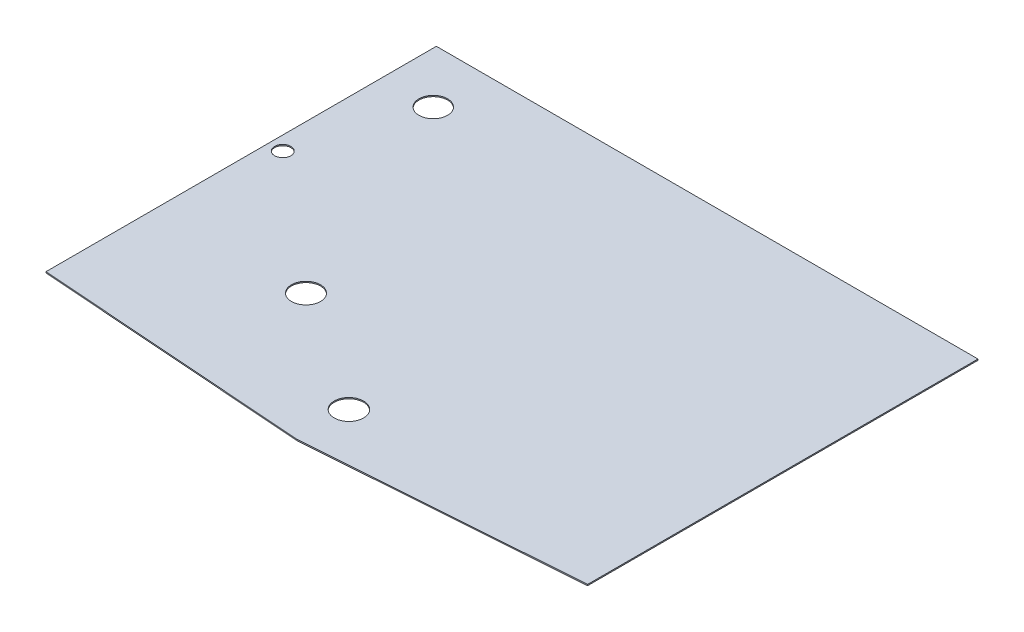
SolidWorks part; units mm, degrees
ref_plane "FRONT" through (0, 0, 0) normal (0, 0, 1) x (1, 0, 0)
ref_plane "TOP" through (0, 0, 0) normal (0, 1, 0) x (1, 0, 0)
ref_plane "RIGHT" through (0, 0, 0) normal (1, 0, 0) x (0, 0, -1)
sketch "Sketch1" plane through (0, 0, 0) normal (0, 1, 0) x (1, 0, 0)
  line L0 (-1111.25, 0) -> (1111.25, 0)
  line L1 (0, 0) -> (0, -4937.7064) construction
  line L2 (1111.25, 0) -> (1111.25, -1601.7875)
  line L3 (-1111.25, 0) -> (-1111.25, -1601.7875)
  line L4 (-1111.25, -1601.7875) -> (0, -1682.75)
  line L5 (0, -1682.75) -> (1111.25, -1601.7875)
  line L6 (1111.25, -1601.7875) -> (-1111.25, -1601.7875) construction
  dimension "D1" = 2222.5
  dimension "D2" = 161.925
  dimension "D3" = 1682.75
sheet metal parameters "Sheet-Metal1" thickness 4.7625 parameters "D1"=4.7625
base flange "Base-Flange1" sketch "Sketch1" thickness 4.7625 reverse thickness direction no parameters "D1"=4.7625
sketch "Sketch2" plane through (0, 0, 0) normal (0, 1, 0) x (1, 0, 0)
  line L0 (1111.25, 0) -> (-1111.25, 0) construction
  line L1 (-1111.25, 0) -> (-1111.25, -1601.7875) construction
  line L2 (-30.5594, 0) -> (30.5594, 0) construction
  circle A0 centre (-901.7, -222.25) radius 58.7375
  circle A1 centre (101.6, -2541.5875) radius 59.5313
  dimension "D1" = 117.475
  dimension "D5" = 119.0625
  dimension "D2" = 222.25
  dimension "D3" = 209.55
  dimension "D4" = 2541.5875
  dimension "D6" = 1212.85
extrude "Cut-Extrude1" cut sketch "Sketch2" against normal through all
sketch "Sketch3" plane through (0, 0, 0) normal (0, 1, 0) x (1, 0, 0)
  line L0 (-1111.25, 0) -> (-1111.25, -1601.7875) construction
  circle A0 centre (-501.65, -1144.5875) radius 59.5313
  circle A1 centre (-1054.1, -687.3875) radius 33.3375
  dimension "D3" = 119.0625
  dimension "D6" = 66.675
  dimension "D1" = 609.6
  dimension "D2" = 457.2
  dimension "D4" = 57.15
  dimension "D5" = 914.4
extrude "Cut-Extrude2" cut sketch "Sketch3" against normal through all
sketch "Sketch4" plane through (0, 0, 0) normal (0, 1, 0) x (1, 0, 0)
  line L30 (-273.2993, -1606.55) -> (301.4591, -1606.55) construction
  line L31 (1111.25, -1601.7875) -> (1111.25, 0) construction
  circle A0 centre (0, -1470.025) radius 60.325
  dimension "D1" = 120.65
  dimension "D2" = 76.2
  dimension "D3" = 1111.25
extrude "Cut-Extrude3" cut sketch "Sketch4" against normal through all
flat pattern "Flat-Pattern1"
sketch "Bend-Lines1" plane through (0, 0, 0) normal (0, 1, 0) x (-1, 0, 0)
